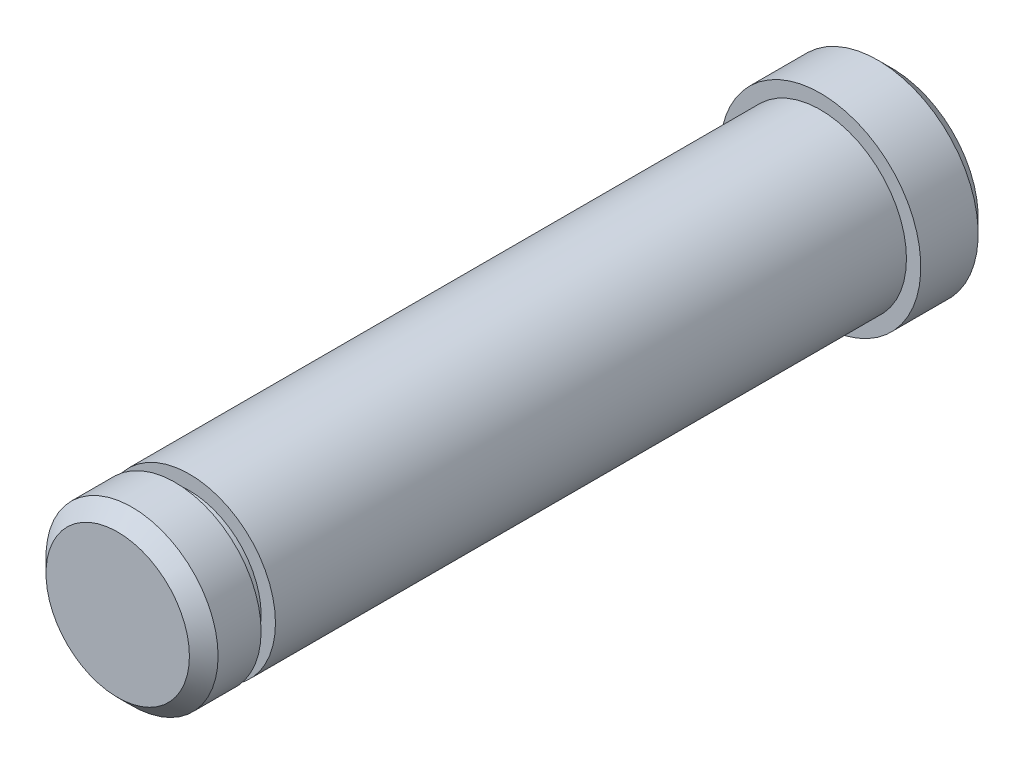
SolidWorks part; units mm, degrees
ref_plane "Płaszczyzna przednia" through (0, 0, 0) normal (0, 0, 1) x (1, 0, 0)
ref_plane "Płaszczyzna górna" through (0, 0, 0) normal (0, 1, 0) x (1, 0, 0)
ref_plane "Płaszczyzna prawa" through (0, 0, 0) normal (1, 0, 0) x (0, 0, -1)
sketch "Sketch1" plane through (0, 0, 0) normal (0, 0, 1) x (1, 0, 0)
  circle A0 centre (0, 0) radius 6
  dimension "D1" = 12
extrude "Boss-Extrude1" add sketch "Sketch1" along normal blind 44
sketch "Sketch2" plane through (0, 0, 0) normal (0, 0, -1) x (-1, 0, 0)
  circle A0 centre (0, 0) radius 7
  dimension "D1" = 14
extrude "Boss-Extrude2" add sketch "Sketch2" along normal blind 5
sketch "Sketch3" plane through (0, 0, 44) normal (0, 0, 1) x (1, 0, 0)
  circle A0 centre (0, 0) radius 5
  dimension "D1" = 10
extrude "Boss-Extrude3" add sketch "Sketch3" along normal blind 1
sketch "Sketch4" plane through (0, 0, 45) normal (0, 0, 1) x (1, 0, 0)
  circle A0 centre (0, 0) radius 6
  dimension "D1" = 12
extrude "Boss-Extrude4" add sketch "Sketch4" along normal blind 4
chamfer "Chamfer1" distance 1 angle 45 2 edges at (-7, 0, -5) (6, 0, 49)
